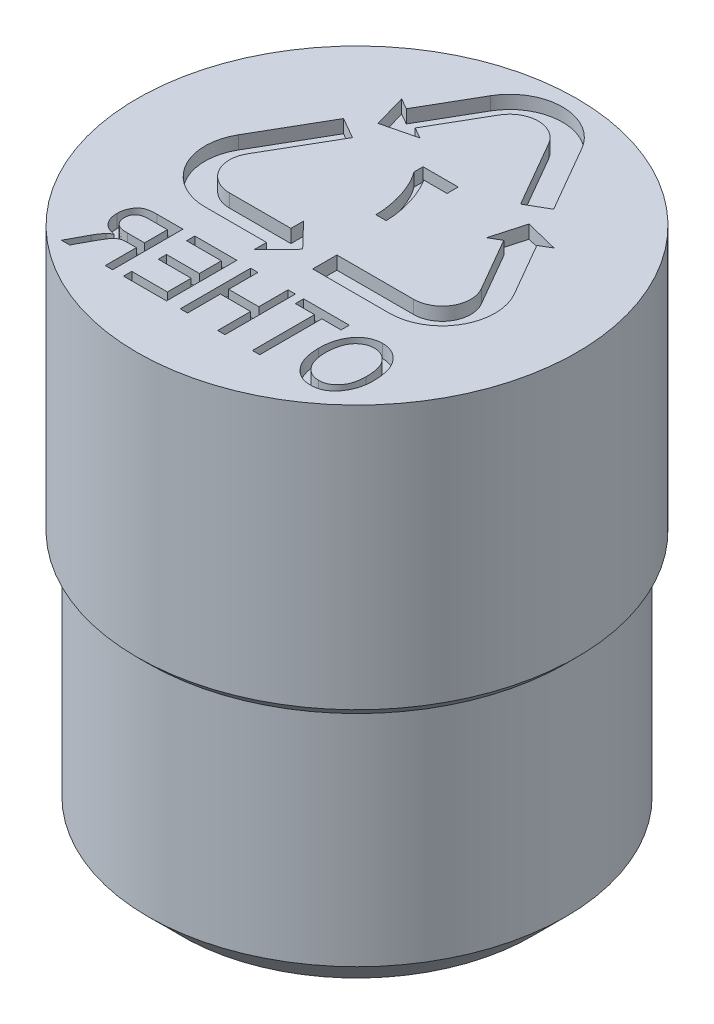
SolidWorks part; units mm, degrees
ref_plane "Front Plane" through (0, 0, 0) normal (0, 0, 1) x (1, 0, 0)
ref_plane "Top Plane" through (0, 0, 0) normal (0, 1, 0) x (1, 0, 0)
ref_plane "Right Plane" through (0, 0, 0) normal (1, 0, 0) x (0, 0, -1)
sketch "Sketch1" plane through (0, 0, 0) normal (0, 0, 1) x (1, 0, 0)
  line L0 (-5, 12) -> (-5, 6)
  line L1 (-5, 6) -> (-4.745, 5.745)
  line L2 (-4.745, 5.745) -> (-4.745, 0)
  line L3 (-4.745, 0) -> (0, 0)
  line L4 (0, 0) -> (0, 12)
  line L5 (0, 12) -> (-5, 12)
  line L6 (0, 36.7698) -> (0, -15.8595) construction
  dimension "D1" = 10
  dimension "D2" = 12
  dimension "D3" = 6
  dimension "D4" = 9.49
  dimension "D5" = 45
revolve "Revolve1" add sketch "Sketch1" angle 360 about L6
chamfer "Chamfer1" distance 0.76 angle 45 1 edges at (0, 0, 4.745)
hole_wizard "M5x0.8 Tapped Hole1" positions "Sketch4" profile "Sketch5" tap size "M5x0.8" standard "ANSI Metric"
sketch "Sketch4" plane through (0, 0, 0) normal (0, -1, 0) x (-1, 0, 0)
  point P0 (0, 0)
sketch "Sketch5" plane through (0, 0, 0) normal (1, 0, 0) x (0, 0, -1)
  line L0 (0, 0) -> (0, 6)
  line L1 (0, 6) -> (2.1, 6)
  line L2 (2.1, 6) -> (2.1, 0)
  line L5 (2.1, 0) -> (0, 0)
  line L10 (0, 6) -> (-2.1, 6) construction
  line L11 (0, -6.35) -> (0, 107.95) construction
  dimension "Tap Drill Dia." = 4.2
  dimension "Tap Drill Depth" = 6
  dimension "Drill Angle" = 180
sketch "Sketch8" plane through (0, 12, 0) normal (0, 1, 0) x (1, 0, 0)
  line L0 (0.5653, 3.7932) -> (1.4379, 2.2818)
  line L1 (1.4379, 2.2818) -> (1.9142, 2.5568)
  line L2 (1.9142, 2.5568) -> (1.0392, 4.0723)
  line L3 (-2.2596, 1.9545) -> (-3.1346, 0.4389)
  line L4 (-1.0392, 4.0723) -> (-1.7392, 2.8599)
  line L5 (-0.5606, 3.7932) -> (-1.2594, 2.5828)
  line L6 (-1.7392, 2.8599) -> (-1.9875, 3.0032)
  line L7 (-1.2594, 2.5828) -> (-1.0111, 2.4395)
  line L8 (-1.0111, 2.4395) -> (-1.7714, 2.25)
  line L9 (-1.7714, 2.25) -> (-1.9875, 3.0032)
  line L10 (-1.7714, 2.25) -> (1.9283, 2.25) construction
  line L11 (0, 0) -> (0, 3.4723) construction
  line L12 (-0.6954, -0.807) -> (-0.6954, -0.5203)
  line L13 (-2.0954, -1.3611) -> (-0.6954, -1.3611)
  line L14 (-0.1511, -1.084) -> (-0.6954, -1.084) construction
  line L15 (-0.6954, -1.3611) -> (-0.6954, -1.6478)
  line L16 (-2.6559, 0.168) -> (-1.7833, 1.6795)
  line L17 (-2.093, -0.807) -> (-0.6954, -0.807)
  line L18 (-0.6954, -0.5203) -> (-0.1511, -1.084)
  line L19 (-0.1511, -1.084) -> (-0.6954, -1.6478)
  line L20 (-0.8541, 0.5556) -> (-2.0954, -0.1611) construction
  line L21 (-1.7833, 1.6795) -> (-2.2596, 1.9545)
  line L22 (-1.7714, 2.25) -> (-2.0214, 1.817) construction
  line L23 (3.1355, 0.4414) -> (2.4358, 1.6534)
  line L24 (2.0963, -0.8086) -> (0.351, -0.8086)
  line L25 (1.9604, 1.3768) -> (1.7125, 1.2327)
  line L26 (0.351, -0.8086) -> (0.351, -1.3586)
  line L27 (0.351, -1.3586) -> (2.0963, -1.3586)
  line L28 (1.9261, 1.9862) -> (2.6836, 1.7976)
  line L29 (1.7125, 1.2327) -> (1.9261, 1.9862)
  line L30 (2.6592, 0.1664) -> (1.9604, 1.3768)
  line L31 (2.4358, 1.6534) -> (2.6836, 1.7976)
  line L32 (1.9604, 1.3768) -> (2.4358, 1.6534) construction
  line L33 (3.1303, -2.2782) -> (3.095, -2.2698) construction
  line L34 (1.9261, 1.9862) -> (2.1981, 1.5151) construction
  line L35 (1.6761, 2.4193) -> (1.9261, 1.9862) construction
  arc A0 (1.0392, 4.0723) -> (-1.0392, 4.0723) centre (0, 3.4723) ccw
  arc A1 (0.5653, 3.7932) -> (-0.5606, 3.7932) centre (0.0024, 3.4682) ccw
  arc A2 (-2.6559, 0.168) -> (-2.093, -0.807) centre (-2.093, -0.157) ccw
  arc A3 (-3.1346, 0.4389) -> (-2.0954, -1.3611) centre (-2.0954, -0.1611) ccw
  arc A4 (2.0963, -0.8086) -> (2.6592, 0.1664) centre (2.0963, -0.1586) ccw
  arc A5 (2.0963, -1.3586) -> (3.1355, 0.4414) centre (2.0963, -0.1586) ccw
  point P49 (0, 4.6723)
  point P50 (-3.2954, -0.1611)
  point P51 (3.2963, -0.1586)
  dimension "D2" = 1.2
  dimension "D3" = 0.65
  dimension "D13" = 1.2
  dimension "D14" = 0.65
  dimension "D1" = 0.55
  dimension "D4" = 60
  dimension "D5" = 1.1275
  dimension "D6" = 0.5443
  dimension "D7" = 0.2867
  dimension "D8" = 1.75
  dimension "D9" = 2.25
  dimension "D10" = 1.4
  dimension "D11" = 30
  dimension "D12" = 60
  dimension "D15" = 0.5541
  dimension "D16" = 90
  dimension "D17" = 60
  dimension "D18" = 30
  dimension "D19" = 0.5
  dimension "D20" = 0.544
  dimension "D21" = 43.99
  dimension "D22" = 30
  dimension "D23" = 0.5
  dimension "D24" = 0.5443
  dimension "D25" = 6.5916
  dimension "D26" = 6.0334
extrude "Cut-Extrude2" cut sketch "Sketch8" against normal blind 0.3
sketch "Sketch12" plane through (0, 12, 0) normal (0, 1, 0) x (1, 0, 0)
  line L0 (0, 0) -> (0, 0.6862) construction
  line L1 (0, 0) -> (0.8877, 0) construction
  text T0 "<b>7</b>" font "Arial Narrow" height 1.5
  dimension "D1" = 0.47
  dimension "D2" = 0.428
extrude "Cut-Extrude3" cut sketch "Sketch12" against normal blind 0.3
sketch "Sketch13" plane through (0, 12, 0) normal (0, 1, 0) x (1, 0, 0)
  text T0 "OTHER" font "Arial Narrow" height 1.6
  dimension "D1" = 3.65
  dimension "D2" = 3.35
extrude "Cut-Extrude4" cut sketch "Sketch13" against normal blind 0.3
